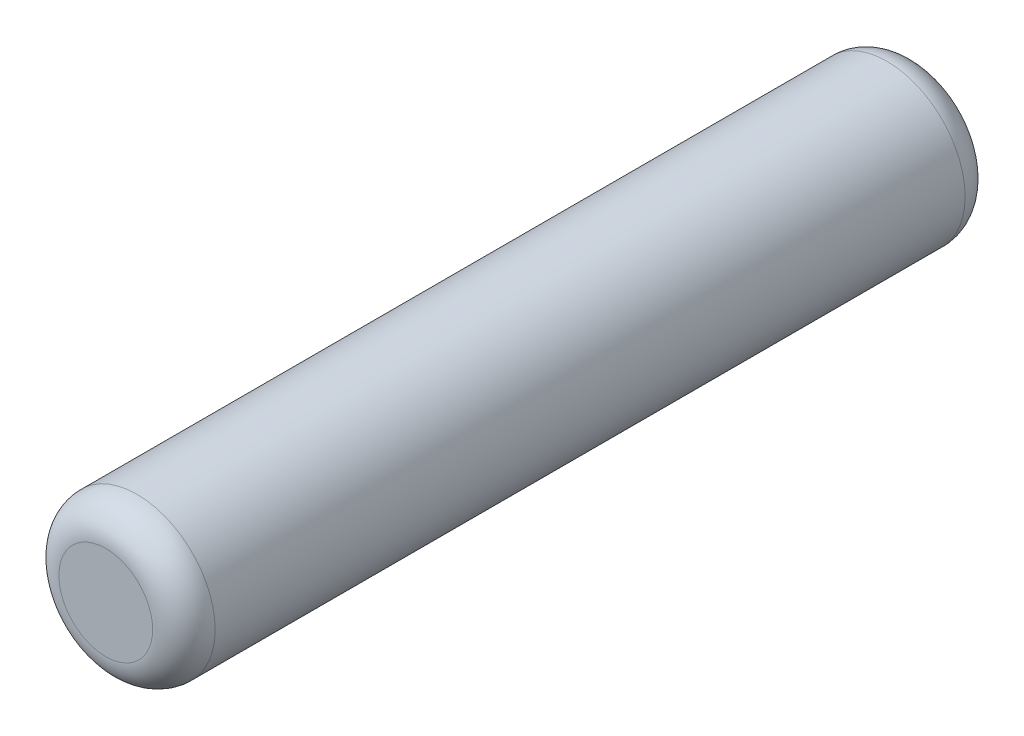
SolidWorks part; units mm, degrees
ref_plane "Спереди" through (0, 0, 0) normal (0, 0, 1) x (1, 0, 0)
ref_plane "Сверху" through (0, 0, 0) normal (0, 1, 0) x (1, 0, 0)
ref_plane "Справа" through (0, 0, 0) normal (1, 0, 0) x (0, 0, -1)
sketch "Эскиз1" plane through (0, 0, 0) normal (0, 0, 1) x (1, 0, 0)
  circle A0 centre (0, 0) radius 1.25
  dimension "D1" = 2.5
extrude "Бобышка-Вытянуть1" add sketch "Эскиз1" along normal mid plane 13
fillet "Скругление1" radius 0.5 2 edges at (1.25, 0, -6.5) (1.25, 0, 6.5)
